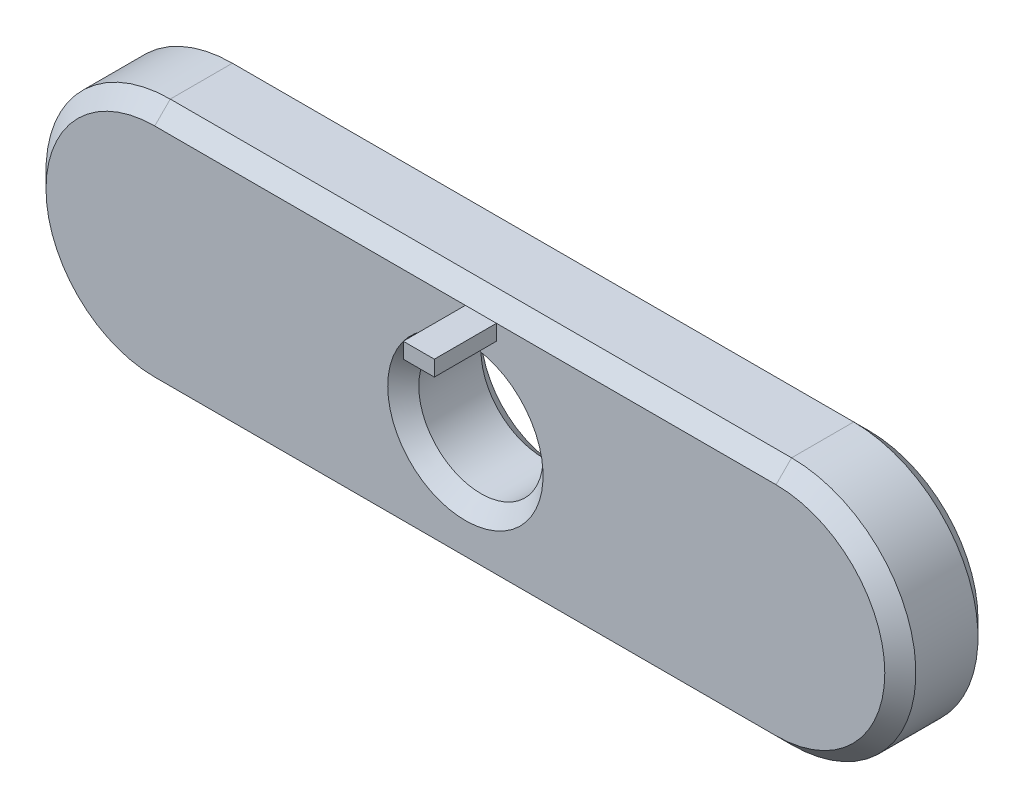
SolidWorks part; units mm, degrees
ref_plane "Plan1" through (0, 0, 0) normal (0, 0, 1) x (1, 0, 0)
ref_plane "Plan2" through (0, 0, 0) normal (0, 1, 0) x (1, 0, 0)
ref_plane "Plan3" through (0, 0, 0) normal (1, 0, 0) x (0, 0, -1)
sketch "Esquisse1" plane through (0, 0, 0) normal (0, 0, 1) x (1, 0, 0)
  line L0 (-10, 4) -> (10, 4)
  line L1 (-10, -4) -> (10, -4)
  arc A0 (10, 4) -> (10, -4) centre (10, 0) cw
  arc A1 (-10, 4) -> (-10, -4) centre (-10, 0) ccw
  point P6 (0, 0)
extrude "Base-Extrusion" add sketch "Esquisse1" along normal blind 3
sketch "Esquisse2" plane through (0, 0, 3) normal (0, 0, 1) x (1, 0, 0)
  circle A0 centre (0, 0) radius 2
  dimension "D1" = 4
extrude "Enlèv. mat.-Extru.1" cut sketch "Esquisse2" against normal blind 3
chamfer "Chanfrein1" distance 0.5 angle 45
sketch "Esquisse3" plane through (0.0321, 1.0632, -10.1157) normal (0.0032, 0.1045, -0.9945) x (-1, 0.0003, -0.0031)
  line L0 (-8.1564, 287.5266) -> (-18.1564, 287.5266) construction
  point P0 (-13.1564, 287.5266)
sketch "Esquisse4" plane through (0, 0, 0) normal (0, 0, 1) x (1, 0, 0)
  line L1 (0, 3.5) -> (1, 3.5)
  line L2 (0, 3.5) -> (0, 3)
  line L3 (0, 3) -> (1, 3)
  line L4 (1, 3.5) -> (1, 3)
extrude "Boss.-Extru.1" add sketch "Esquisse4" along normal blind 5
